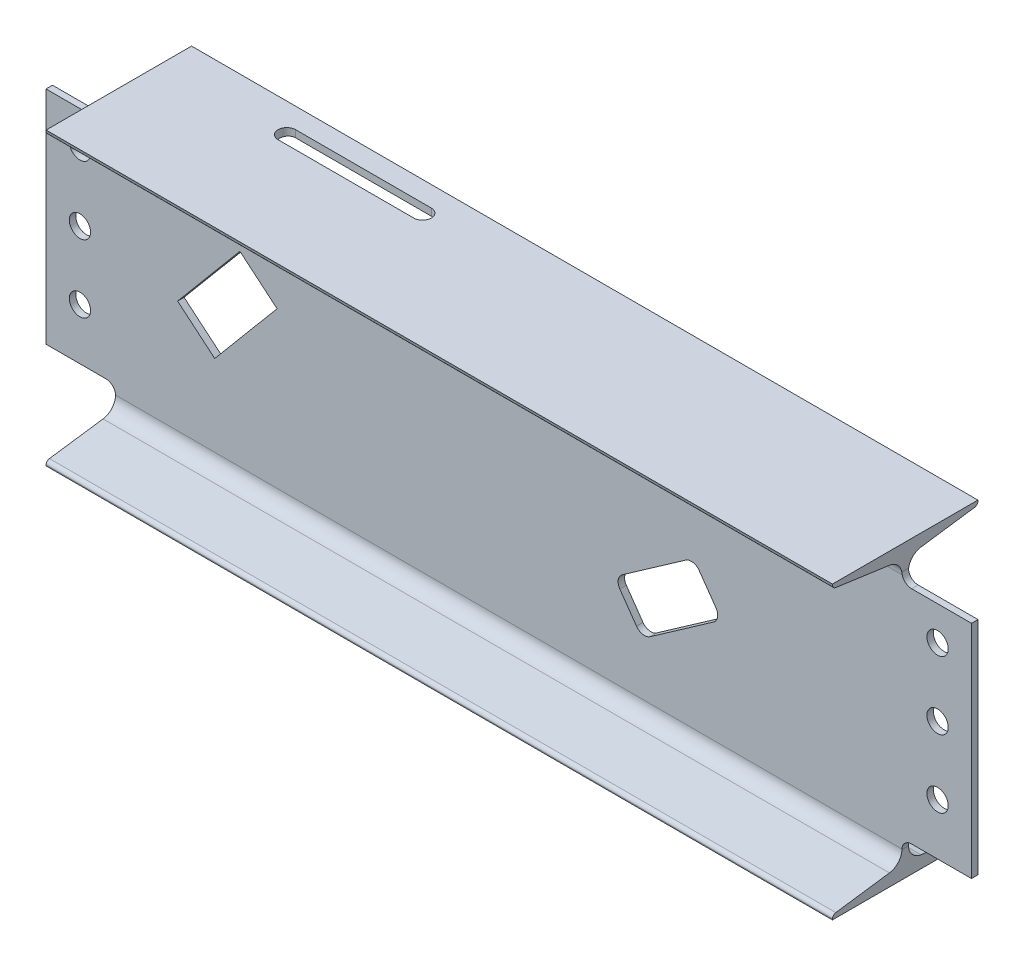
SolidWorks part; units mm, degrees
ref_plane "Front Plane" through (0, 0, 0) normal (0, 0, 1) x (1, 0, 0)
ref_plane "Top Plane" through (0, 0, 0) normal (0, 1, 0) x (1, 0, 0)
ref_plane "Right Plane" through (0, 0, 0) normal (1, 0, 0) x (0, 0, -1)
sketch "Member Sketch" plane through (0, 0, 0) normal (0, 1, 0) x (1, 0, 0)
  line L0 (0, 0) -> (1000, 0)
  line L2 (0, 0) -> (1000, 0) construction
other "Structural Member1"
ref_plane "Plane1" through (0, 0, 0) normal (1, 0, 0) x (0, 0, -1)
sketch "Sketch1" plane through (0, -150, 0) normal (1, 0, 0) x (0, 0, -1)
  line L0 (-75, 150) -> (75, 150)
  line L1 (75, 150) -> (75, 149.112)
  line L2 (71.5567, 145.151) -> (16.2624, 137.3798)
  line L3 (3.35, 122.5258) -> (3.35, -122.5258)
  line L4 (-3.35, 0) -> (3.35, 0) construction
  line L5 (0, -150) -> (0, 150) construction
  line L6 (-3.35, 122.5258) -> (-3.35, -122.5258)
  line L7 (-71.5567, 145.151) -> (-16.2624, 137.3798)
  line L8 (-75, 150) -> (-75, 149.112)
  line L9 (-75, -150) -> (-75, -149.112)
  line L10 (-71.5567, -145.151) -> (-16.2624, -137.3798)
  line L11 (71.5567, -145.151) -> (16.2624, -137.3798)
  line L12 (75, -150) -> (75, -149.112)
  line L13 (-75, -150) -> (75, -150)
  line L14 (-75, 145.6349) -> (-75, -145.6349) construction
  line L15 (75, 145.6349) -> (75, -145.6349) construction
  line L16 (-3.35, 0) -> (-75, 0) construction
  line L17 (3.35, 0) -> (75, 0) construction
  line L18 (39.175, 140.6) -> (39.175, -150) construction
  line L19 (0, 122.5258) -> (75, 122.5258) construction
  arc A0 (16.2624, 137.3798) -> (3.35, 122.5258) centre (18.35, 122.5258) ccw
  arc A1 (71.5567, -145.151) -> (75, -149.112) centre (71, -149.112) cw
  arc A2 (-71.5567, -145.151) -> (-75, -149.112) centre (-71, -149.112) ccw
  arc A3 (-16.2624, 137.3798) -> (-3.35, 122.5258) centre (-18.35, 122.5258) cw
  arc A4 (-16.2624, -137.3798) -> (-3.35, -122.5258) centre (-18.35, -122.5258) ccw
  arc A5 (-71.5567, 145.151) -> (-75, 149.112) centre (-71, 149.112) cw
  arc A6 (75, 149.112) -> (71.5567, 145.151) centre (71, 149.112) cw
  arc A7 (16.2624, -137.3798) -> (3.35, -122.5258) centre (18.35, -122.5258) cw
  point P25 (0, 0)
  point P44 (39.175, 0)
  dimension "Root Radius(r)" = 15
  dimension "Flange Radius(r2)" = 4
  dimension "Section Depth(D)" = 300
  dimension "Flange Width(B)" = 150
  dimension "Web Thickness(t)" = 6.7
  dimension "Flange Thickness(T)" = 9.4
  dimension "FlangeSlope" = 98
sketch "Sketch2" plane through (0, 0, 0) normal (0, 1, 0) x (1, 0, 0)
  line L0 (500, 0) -> (1500, 0) construction
  line L1 (0, -55) -> (0, 55) construction
  line L2 (-550, 0) -> (550, 0) construction
  text T0 "LB 300" font "Century Gothic" height 30
  dimension "D1" = 500
  dimension "D2" = 1000
extrude "MARKING" [suppressed] cut sketch "Sketch2" against normal blind 1
other "0008-AABE004-CN03-FP01D02-1 - MEMBER2 CAVITY"
other "0008-AABE004<1>@0008-AA/0008-AABE004-CN03-FP01<1>@0008-AABE004/0008-AABE004-CN03-FP01D02<1>@0008-AABE004-CN03-FP011"
other "0008-AABE004-CN03-FP01D01-1 - MEMBER2 CAVITY"
other "0008-AABE004<1>@0008-AA/0008-AABE004-CN03-FP01<1>@0008-AABE004/0008-AABE004-CN03-FP01D01<1>@0008-AABE004-CN03-FP011"
other "0008-AABE002-CN03-FP01D02-1 - MEMBER2 CAVITY"
other "0008-AABE002<1>@0008-AA/0008-AABE002-CN03-FP01<1>@0008-AABE002/0008-AABE002-CN03-FP01D02<1>@0008-AABE002-CN03-FP011"
other "0008-AABE002-CN03-FP01D01-1 - MEMBER2 CAVITY"
other "0008-AABE002<1>@0008-AA/0008-AABE002-CN03-FP01<1>@0008-AABE002/0008-AABE002-CN03-FP01D01<1>@0008-AABE002-CN03-FP011"
sketch "Sketch3" plane through (0, 0, 0) normal (0, 1, 0) x (1, 0, 0)
  line L0 (222.75, 45) -> (362.75, 45) construction
  line L1 (222.75, 54) -> (362.75, 54)
  line L2 (222.75, 36) -> (362.75, 36)
  line L3 (0, 0) -> (1000, 0) construction
  arc A0 (222.75, 54) -> (222.75, 36) centre (222.75, 45) ccw
  arc A1 (362.75, 36) -> (362.75, 54) centre (362.75, 45) ccw
  point P2 (292.75, 45)
  dimension "D1" = 200
  dimension "D2" = 140
  dimension "D3" = 18
  dimension "D4" = 45
extrude "Cut-Extrude1" cut sketch "Sketch3" against normal through all
sketch "Sketch4" plane through (0, 0, 3.35) normal (0, 0, 1) x (1, 0, 0)
  line L0 (158.4712, -156.6044) -> (196.7735, -188.7438)
  line L1 (158.4712, -156.6044) -> (222.75, -80)
  line L2 (196.7735, -188.7438) -> (261.0522, -112.1394)
  line L3 (222.75, -80) -> (261.0522, -112.1394)
  line L4 (0, 0) -> (1000, 0) construction
  line L5 (905.5, -299.112) -> (94.5, -299.112) construction
  line L6 (22.75, -263) -> (22.75, -35) construction
  line L7 (614.5585, -185.7358) -> (631.7658, -210.3103)
  line L8 (617.0142, -171.8085) -> (682.5464, -125.9224)
  line L9 (645.6931, -212.7661) -> (711.2252, -166.88)
  line L10 (696.4737, -128.3781) -> (713.681, -152.9527)
  line L11 (905.5, -300) -> (94.5, -300) construction
  arc A0 (617.0142, -171.8085) -> (614.5585, -185.7358) centre (622.75, -180) ccw
  arc A1 (631.7658, -210.3103) -> (645.6931, -212.7661) centre (639.9573, -204.5746) ccw
  arc A2 (713.681, -152.9527) -> (711.2252, -166.88) centre (705.4895, -158.6884) cw
  arc A3 (696.4737, -128.3781) -> (682.5464, -125.9224) centre (688.2822, -134.1139) ccw
  point P16 (608.8227, -177.5442)
  point P19 (637.5015, -218.5018)
  point P24 (690.7379, -120.1866)
  dimension "D8" = 10
  dimension "D1" = 100
  dimension "D2" = 50
  dimension "D3" = 80
  dimension "D4" = 50
  dimension "D5" = 200
  dimension "D6" = 100
  dimension "D7" = 50
  dimension "D9" = 600
  dimension "D10" = 35
  dimension "D11" = 180
extrude "Cut-Extrude2" cut sketch "Sketch4" against normal through all
